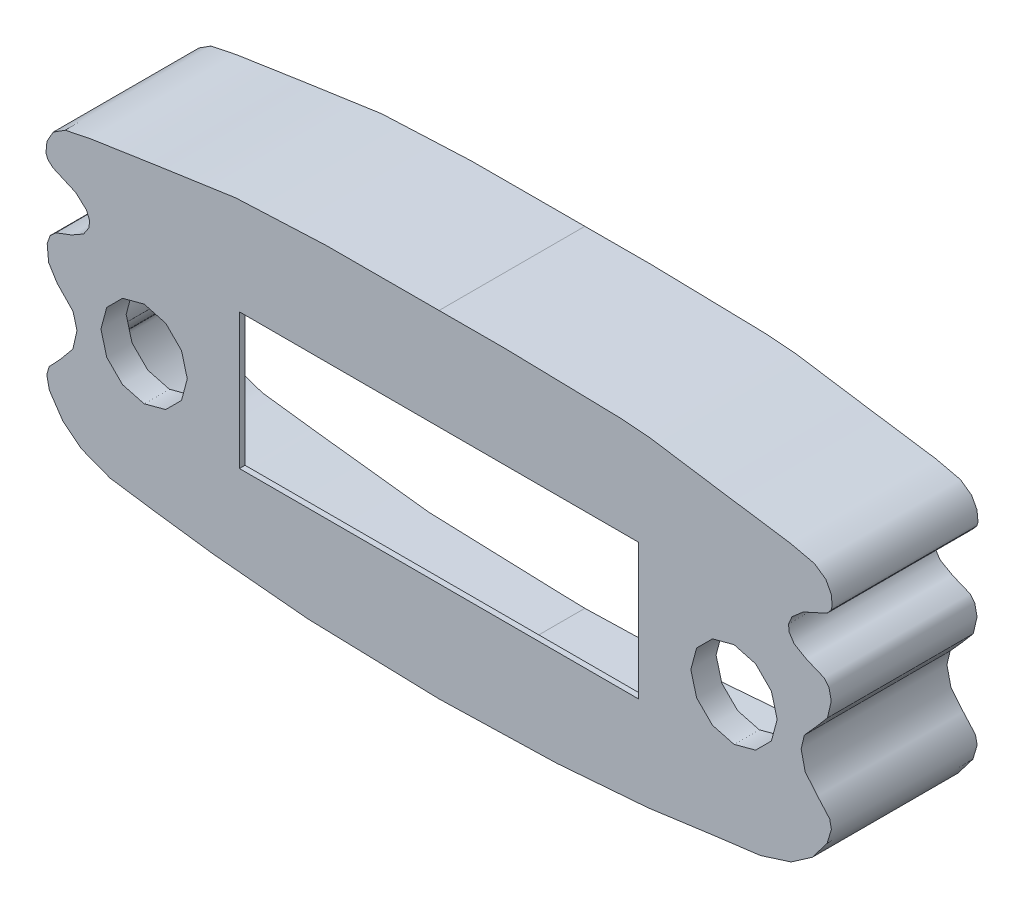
SolidWorks part; units mm, degrees
ref_plane "Plan de face" through (0, 0, 0) normal (0, 0, 1) x (1, 0, 0)
ref_plane "Plan de dessus" through (0, 0, 0) normal (0, 1, 0) x (1, 0, 0)
ref_plane "Plan de droite" through (0, 0, 0) normal (1, 0, 0) x (0, 0, -1)
sketch "Esquisse1" plane through (0, 0, 0) normal (0, 0, 1) x (1, 0, 0)
  line L0 (70, 60) -> (70, 0) construction
  line L1 (0, 0) -> (140, 0) construction
  line L2 (0, 0) -> (0, 60) construction
  line L3 (0, 60) -> (140, 60) construction
  line L4 (140, 0) -> (140, 60) construction
  line L5 (35, 60) -> (35, 0) construction
  line L7 (105, 60) -> (105, 0) construction
  line L9 (140, 30) -> (0, 30) construction
  spline S0 degree 3 poles (70, 60) (54.7248, 59.9313) (33.0427, 60.7234) (11.6943, 55.2797) (0.503, 55.3001) (-0.6108, 47.2311) (5.1991, 46.8718) (8.5103, 42.6238) (5.7409, 38.4991) (-0.3802, 38.6206) (-0.0258, 30.5686) (5.9762, 27.8053) (5.4008, 19.9886) (-1.6581, 16.4736) (4.9003, 4.276) (18.6256, 4.107) (40.916, 0.2287) (57.5641, 0.3891) (70, 0) knots 0 0 0 0 0.248899 0.308695 0.367852 0.382352 0.414488 0.437211 0.450712 0.482635 0.511679 0.542546 0.575625 0.609335 0.642182 0.746334 0.803904 1 1 1 1
  spline S1 degree 3 poles (70, 60) (85.2752, 59.9313) (106.9573, 60.7234) (128.3057, 55.2797) (139.497, 55.3001) (140.6108, 47.2311) (134.8009, 46.8718) (131.4897, 42.6238) (134.2591, 38.4991) (140.3802, 38.6206) (140.0258, 30.5686) (134.0238, 27.8053) (134.5992, 19.9886) (141.6581, 16.4736) (135.0997, 4.276) (121.3744, 4.107) (99.084, 0.2287) (82.4359, 0.3891) (70, 0) knots 0 0 0 0 0.248899 0.308695 0.367852 0.382352 0.414488 0.437211 0.450712 0.482635 0.511679 0.542546 0.575625 0.609335 0.642182 0.746334 0.803904 1 1 1 1
  spline S2 degree 1 poles (70, 59) (70, 1.0005) knots 0 0 1 1 construction
  spline S3 degree 1 poles (70, 59) (70, 1.0005) knots 0 0 1 1 construction
  spline S4 degree 3 number of poles 76 (70, 59) -> (70, 1.0005)
  spline S5 degree 3 number of poles 76 (70, 1.0005) -> (70, 59)
  dimension "D1" = 140
  dimension "D2" = 60
  dimension "D3" = 35
  dimension "D4" = 35
  dimension "D5" = 1
extrude "Boss.-Extru.2" add sketch "Esquisse1" along normal blind 25
sketch "Esquisse2" plane through (0, 0, 25) normal (0, 0, 1) x (1, 0, 0)
  spline S2 degree 3 poles (1300.4817, -3791.236) (-286.3465, 239.6239) (-43.3281, -24.5499) (121.3744, 4.107) (135.0997, 4.276) (141.6581, 16.4736) (134.5992, 19.9886) (134.0238, 27.8053) (140.0258, 30.5686) (140.3802, 38.6206) (134.2591, 38.4991) (131.4897, 42.6238) (134.8009, 46.8718) (140.6108, 47.2311) (139.497, 55.3001) (128.3057, 55.2797) (-15.6089, 91.9767) (-387.7181, -201.8014) (3002.2456, 2775.5597) knots -2.286087 -2.286087 -2.286087 -2.286087 0.196096 0.253666 0.357818 0.390665 0.424375 0.457454 0.488321 0.517365 0.549288 0.562789 0.585512 0.617648 0.632148 0.691305 0.751101 3.111926 3.111926 3.111926 3.111926 only from (70, 0) to (70, 60)
  spline S3 degree 3 poles (-2862.1534, 2775.4788) (527.7116, -201.7962) (155.6077, 91.9763) (11.6943, 55.2797) (0.503, 55.3001) (-0.6108, 47.2311) (5.1991, 46.8718) (8.5103, 42.6238) (5.7409, 38.4991) (-0.3802, 38.6206) (-0.0258, 30.5686) (5.9762, 27.8053) (5.4008, 19.9886) (-1.6581, 16.4736) (4.9003, 4.276) (18.6256, 4.107) (183.3279, -24.5498) (426.3462, 239.6235) (-1160.4784, -3791.2279) knots -2.111904 -2.111904 -2.111904 -2.111904 0.248899 0.308695 0.367852 0.382352 0.414488 0.437211 0.450712 0.482635 0.511679 0.542546 0.575625 0.609335 0.642182 0.746334 0.803904 3.286086 3.286086 3.286086 3.286086 only from (70, 60) to (70, 0)
  spline S4 degree 3 poles (70, 0) (82.4359, 0.3891) (99.084, 0.2287) (121.3744, 4.107) (135.0997, 4.276) (141.6581, 16.4736) (134.5992, 19.9886) (134.0238, 27.8053) (140.0258, 30.5686) (140.3802, 38.6206) (134.2591, 38.4991) (131.4897, 42.6238) (134.8009, 46.8718) (140.6108, 47.2311) (139.497, 55.3001) (128.3057, 55.2797) (106.9573, 60.7234) (85.2752, 59.9313) (70, 60) knots 0 0 0 0 0.196096 0.253666 0.357818 0.390665 0.424375 0.457454 0.488321 0.517365 0.549288 0.562789 0.585512 0.617648 0.632148 0.691305 0.751101 1 1 1 1
  spline S5 degree 3 poles (70, 60) (54.7248, 59.9313) (33.0427, 60.7234) (11.6943, 55.2797) (0.503, 55.3001) (-0.6108, 47.2311) (5.1991, 46.8718) (8.5103, 42.6238) (5.7409, 38.4991) (-0.3802, 38.6206) (-0.0258, 30.5686) (5.9762, 27.8053) (5.4008, 19.9886) (-1.6581, 16.4736) (4.9003, 4.276) (18.6256, 4.107) (40.916, 0.2287) (57.5641, 0.3891) (70, 0) knots 0 0 0 0 0.248899 0.308695 0.367852 0.382352 0.414488 0.437211 0.450712 0.482635 0.511679 0.542546 0.575625 0.609335 0.642182 0.746334 0.803904 1 1 1 1
  dimension "D1" = 0
extrude "Boss.-Extru.3" add sketch "Esquisse2" along normal blind 1
sketch "Esquisse3" plane through (0, 0, 26) normal (0, 0, 1) x (1, 0, 0)
  line L1 (34.4, 41.9904) -> (105.6, 41.9904)
  line L2 (34.4, 41.9904) -> (34.4, 17.7904)
  line L3 (34.4, 17.7904) -> (105.6, 17.7904)
  line L4 (105.6, 41.9904) -> (105.6, 17.7904)
  circle A0 centre (17.4, 26.9904) radius 7.7
  circle A1 centre (122.6, 26.9904) radius 7.7
  dimension "D3" = 15.4
  dimension "D4" = 15.4
  dimension "D1" = 71.2
  dimension "D2" = 24.2
  dimension "D5" = 17
  dimension "D6" = 17
  dimension "D7" = 35.6
  dimension "D8" = 15
  dimension "D9" = 15
extrude "Enlèv. mat.-Extru.1" cut sketch "Esquisse3" against normal blind 10
sketch "Esquisse4" plane through (0, 0, 25) normal (0, 0, -1) x (-1, 0, 0)
  circle A0 centre (-122.6, 26.9904) radius 7.7
  circle A1 centre (-17.4, 26.9904) radius 7.7
  circle A2 centre (-122.6, 26.9904) radius 8.7
  circle A3 centre (-17.4, 26.9904) radius 8.7
  dimension "D1" = 15.4
  dimension "D2" = 15.4
  dimension "D3" = 1
extrude "Boss.-Extru.4" add sketch "Esquisse4" along normal blind 3.5
